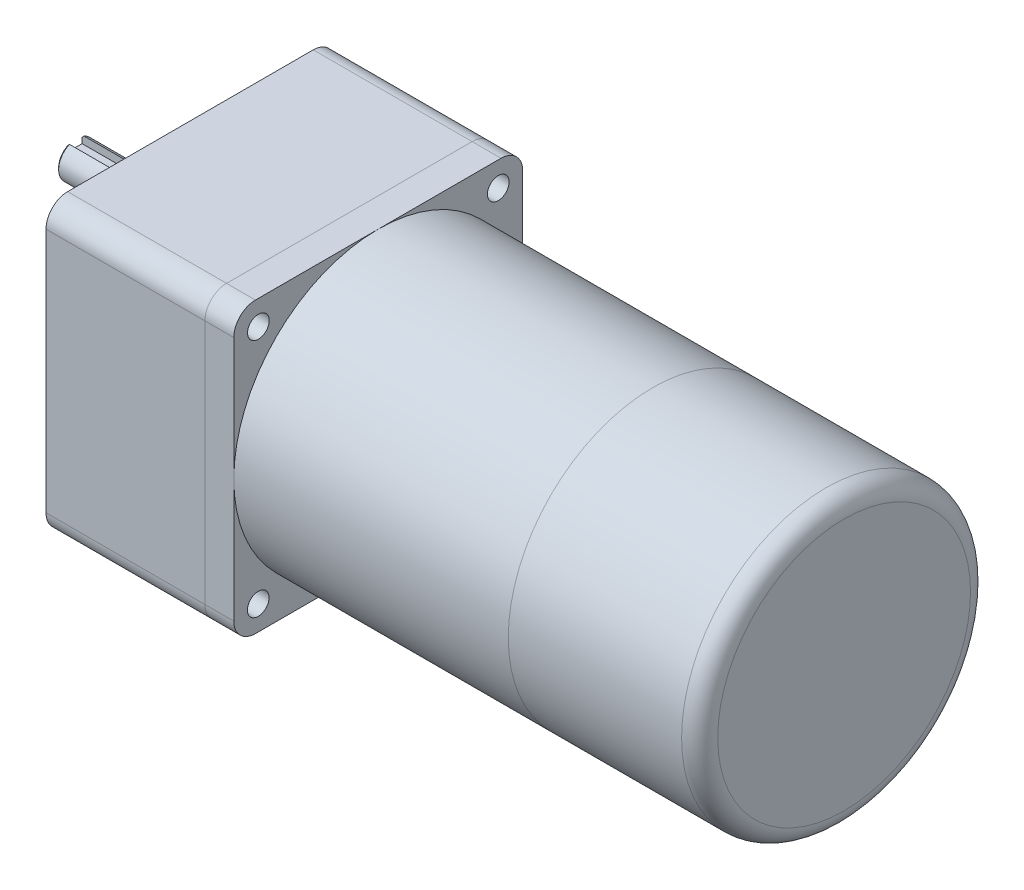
SolidWorks part; units mm, degrees
ref_plane "前视基准面" through (0, 0, 0) normal (0, 0, 1) x (1, 0, 0)
ref_plane "上视基准面" through (0, 0, 0) normal (0, 1, 0) x (1, 0, 0)
ref_plane "右视基准面" through (0, 0, 0) normal (1, 0, 0) x (0, 0, -1)
sketch "草图1" plane through (0, 0, 0) normal (1, 0, 0) x (0, 0, -1)
  line L1 (-34, -40) -> (34, -40)
  line L2 (-40, -34) -> (-40, 34)
  line L3 (-34, 40) -> (34, 40)
  line L4 (40, -34) -> (40, 34)
  line L5 (-40, -40) -> (40, 40) construction
  line L6 (-40, 40) -> (40, -40) construction
  arc A0 (-40, 34) -> (-34, 40) centre (-34, 34) cw
  arc A1 (-34, -40) -> (-40, -34) centre (-34, -34) cw
  arc A2 (34, -40) -> (40, -34) centre (34, -34) ccw
  arc A3 (34, 40) -> (40, 34) centre (34, 34) cw
  point P0 (0, 0)
  dimension "D1" = 6
extrude "凸台-拉伸1" add sketch "草图1" along normal blind 44
sketch "草图2" plane through (44, 0, 0) normal (1, 0, 0) x (0, 0, -1)
  line L0 (34, 40) -> (-34, 40) construction
  line L1 (-34, -40) -> (34, -40)
  line L2 (-40, -34) -> (-40, 34)
  line L3 (-34, 40) -> (34, 40)
  line L4 (40, -34) -> (40, 34)
  line L5 (-40, -40) -> (40, 40) construction
  line L6 (-40, 40) -> (40, -40) construction
  arc A0 (-34, -40) -> (-40, -34) centre (-34, -34) cw
  arc A1 (34, -40) -> (40, -34) centre (34, -34) ccw
  arc A2 (34, 40) -> (40, 34) centre (34, 34) cw
  arc A3 (-40, 34) -> (-34, 40) centre (-34, 34) cw
  point P0 (0, 0)
  dimension "D1" = 6
extrude "凸台-拉伸2" add sketch "草图2" along normal blind 8 separate body
sketch "草图3" plane through (52, 0, 0) normal (1, 0, 0) x (0, 0, -1)
  circle A0 centre (0, 0) radius 40
extrude "凸台-拉伸3" add sketch "草图3" along normal blind 76 separate body
sketch "草图4" plane through (128, 0, 0) normal (1, 0, 0) x (0, 0, -1)
  circle A0 centre (0, 0) radius 40
extrude "凸台-拉伸4" add sketch "草图4" along normal blind 53 separate body
fillet "圆角1" radius 5 1 edges at (181, 0, -40)
sketch "草图5" plane through (0, 0, 0) normal (-1, 0, 0) x (0, 0, 1)
  point P19 (-33.234, 33.234)
  point P20 (33.234, 33.234)
  point P21 (33.234, -33.234)
  point P22 (-33.234, -33.234)
hole_wizard "M5 螺纹孔2" positions "3D草图2" profile "草图7" tap size "M5" standard "GB"
sketch3d "3D草图2"
  point P0 (0, 33.234, -33.234)
  point P3 (0, 33.234, 33.234)
  point P6 (0, -33.234, 33.234)
  point P9 (0, -33.234, -33.234)
sketch "草图7" plane through (0, 33.234, -33.234) normal (0, 1, 0) x (0, 0, 1)
  line L0 (0, 0) -> (0, 15.2618)
  line L1 (0, 15.2618) -> (2.1, 14)
  line L2 (2.1, 14) -> (2.1, 0)
  line L5 (2.1, 0) -> (0, 0)
  line L10 (0, 15.2618) -> (-2.1, 14) construction
  line L11 (0, -6.35) -> (0, 107.95) construction
  dimension "螺纹孔钻头直径" = 4.2
  dimension "螺纹孔钻头深度" = 14
  dimension "导头角度" = 118
sketch "草图8" plane through (52, 0, 0) normal (1, 0, 0) x (0, 0, -1)
  circle A5 centre (-33.1907, 33.1907) radius 3
  circle A6 centre (33.234, 33.234) radius 3
  circle A7 centre (33.234, -33.234) radius 3
  circle A8 centre (-33.234, -33.234) radius 3
extrude "切除-拉伸2" cut sketch "草图8" against normal blind 26
sketch "草图9" plane through (0, 0, 0) normal (-1, 0, 0) x (0, 0, 1)
  circle A0 centre (0, 15) radius 15
extrude "凸台-拉伸5" add sketch "草图9" along normal blind 3.7 separate body
fillet "圆角2" radius 0.5 1 edges at (-3.7, 15, 15)
sketch "草图10" plane through (-3.7, 0, 0) normal (-1, 0, 0) x (0, 0, 1)
  circle A0 centre (0, 15) radius 5
extrude "凸台-拉伸6" add sketch "草图10" along normal blind 28.3 separate body
ref_plane "基准面1" through (0, 20, 0) normal (0, 1, 0) x (1, 0, 0)
sketch "草图11" plane through (0, 20, 0) normal (0, 1, 0) x (1, 0, 0)
  line L1 (-32, 5) -> (-32, -5) construction
  line L2 (-9, 2) -> (-32, 2)
  line L3 (-32, 2) -> (-32, -2)
  line L4 (-32, -2) -> (-9, -2)
  arc A0 (-9, -2) -> (-9, 2) centre (-9, 0) ccw
extrude "切除-拉伸3" cut sketch "草图11" against normal blind 2.5
chamfer "倒角1" distance 0.5 angle 45 1 edges at (-32, 10, 0)
sketch "草图12" plane through (0, 0, 0) normal (-1, 0, 0) x (0, 0, 1)
  circle A0 centre (0, 0) radius 38
extrude "切除-拉伸4" cut sketch "草图12" against normal blind 0.5
fillet "圆角3" radius 0.5 1 edges at (0.5, 0, 38)
